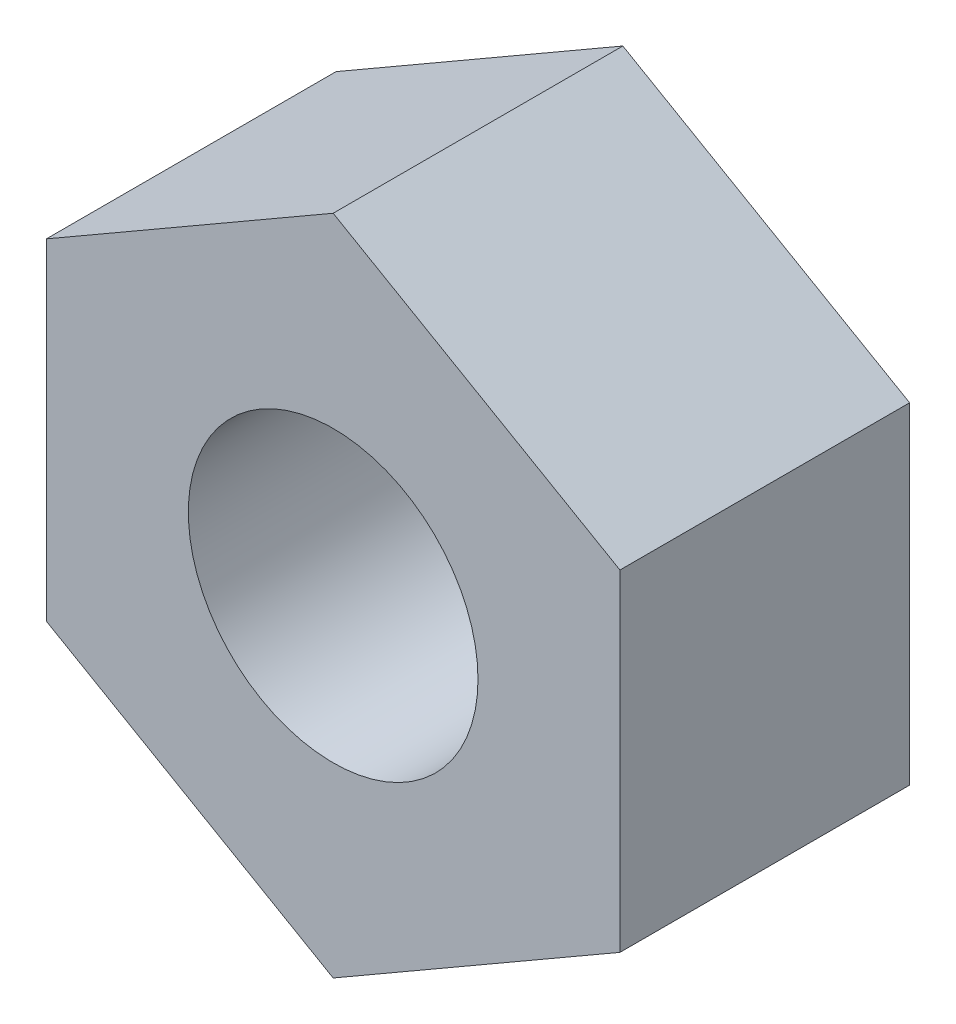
SolidWorks part; units mm, degrees
ref_plane "Plan de face" through (0, 0, 0) normal (0, 0, 1) x (1, 0, 0)
ref_plane "Plan de dessus" through (0, 0, 0) normal (0, 1, 0) x (1, 0, 0)
ref_plane "Plan de droite" through (0, 0, 0) normal (1, 0, 0) x (0, 0, -1)
sketch "Esquisse1" plane through (0, 0, 0) normal (0, 0, 1) x (1, 0, 0)
  line L0 (0, 37.3944) -> (0, -44.9204) construction
  line L2 (48.5657, 0) -> (-61.0306, 0) construction
  line L3 (0, 5.7158) -> (-4.95, 2.8579)
  line L4 (-4.95, 2.8579) -> (-4.95, -2.8579)
  line L5 (-4.95, -2.8579) -> (0, -5.7158)
  line L6 (0, -5.7158) -> (4.95, -2.8579)
  line L7 (4.95, -2.8579) -> (4.95, 2.8579)
  line L8 (4.95, 2.8579) -> (0, 5.7158)
  circle A0 centre (0, 0) radius 2.5
  circle A1 centre (0, 0) radius 4.95 construction
extrude "Extrusion1" add sketch "Esquisse1" along normal blind 5
